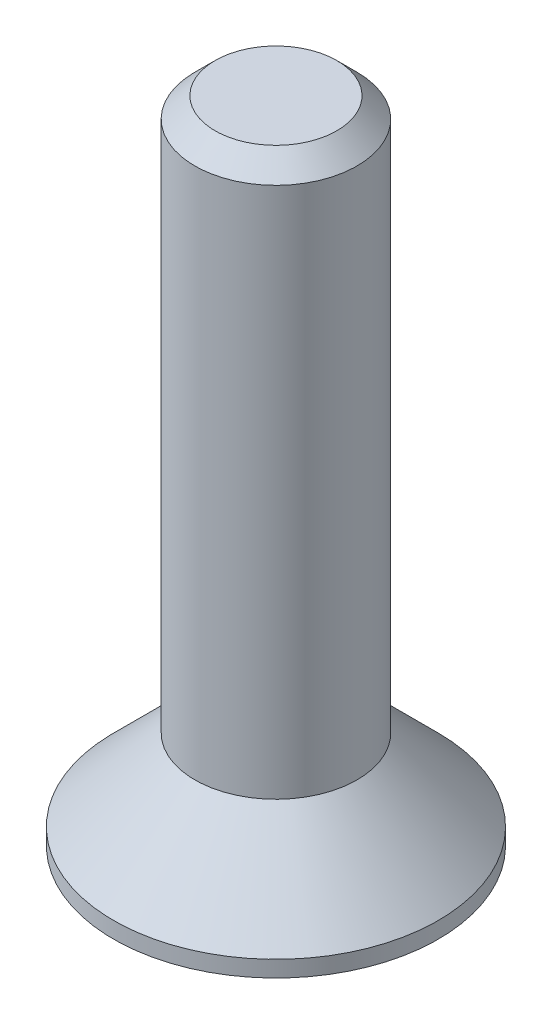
SolidWorks part; units mm, degrees
ref_plane "Plan de face" through (0, 0, 0) normal (0, 0, 1) x (1, 0, 0)
ref_plane "Plan de dessus" through (0, 0, 0) normal (0, 1, 0) x (1, 0, 0)
ref_plane "Plan de droite" through (0, 0, 0) normal (1, 0, 0) x (0, 0, -1)
sketch "Esquisse1" plane through (0, 0, 0) normal (0, 0, 1) x (1, 0, 0)
  line L0 (0, 0) -> (0, 35.9816) construction
  line L1 (0, -55) -> (0, 55) construction
  line L2 (0, 0) -> (-4, 0)
  line L3 (-4, 0) -> (-4, 0.4)
  line L4 (-4, 0.4) -> (-2, 2.4)
  line L5 (-2, 2.4) -> (-2, 16)
  line L6 (-2, 16) -> (0, 16)
  line L7 (0, 16) -> (0, 0)
  dimension "D1" = 4
  dimension "D2" = 45
  dimension "D3" = 8
  dimension "D4" = 2.4
  dimension "D5" = 16
revolve "Révolution1" add sketch "Esquisse1" angle 360 about L0
chamfer "Chanfrein1" distance 0.5 angle 45 1 edges at (0, 16, -2)
sketch "Esquisse3" plane through (0, 0, 0) normal (0, -1, 0) x (1, 0, 0)
  line L1 (1.25, 0.7217) -> (0, 1.4434)
  line L2 (0, 1.4434) -> (-1.25, 0.7217)
  line L3 (-1.25, 0.7217) -> (-1.25, -0.7217)
  line L4 (-1.25, -0.7217) -> (0, -1.4434)
  line L5 (0, -1.4434) -> (1.25, -0.7217)
  line L6 (1.25, -0.7217) -> (1.25, 0.7217)
  circle A1 centre (0, 0) radius 1.25 construction
  dimension "D1" = 2.5
extrude "Enlèv. mat.-Extru.1" cut sketch "Esquisse3" against normal blind 2
